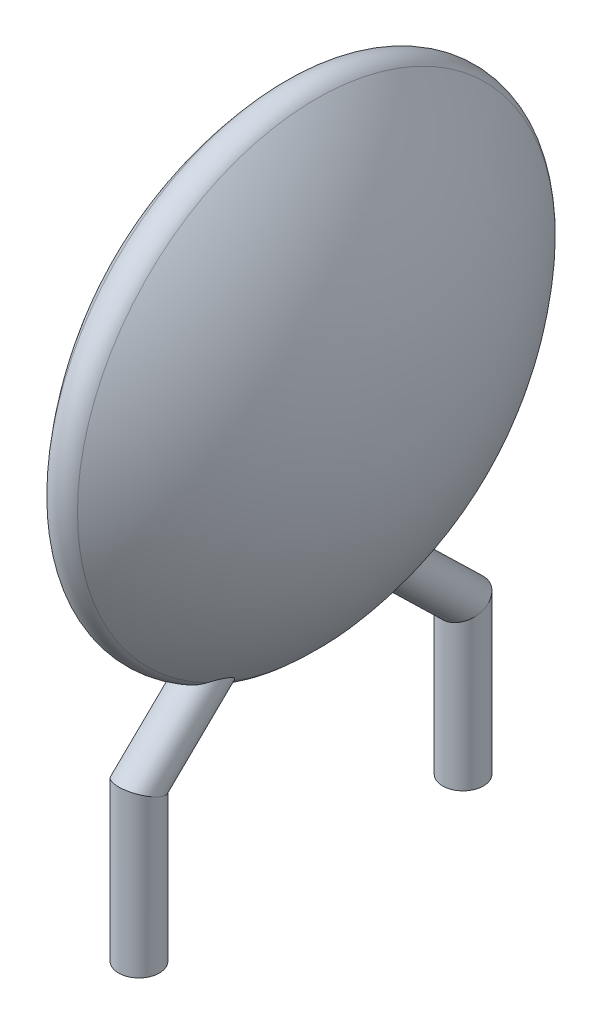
SolidWorks part; units mm, degrees
ref_plane "Plan1" through (0, 0, 0) normal (0, 0, 1) x (1, 0, 0)
ref_plane "Plan2" through (0, 0, 0) normal (0, 1, 0) x (1, 0, 0)
ref_plane "Plan3" through (0, 0, 0) normal (1, 0, 0) x (0, 0, -1)
sketch "Esquisse1" plane through (0, 0, 0) normal (0, 0, 1) x (1, 0, 0)
  line L0 (0, 0) -> (40, 0) construction
  line L1 (0, 2.5) -> (20, 2.5) construction
  line L2 (-1, 2.2331) -> (-1, -1.0149) construction
  line L3 (0, 0) -> (-2.4827, 0) construction
  line L4 (0, 0) -> (0, 3.6725) construction
  line L5 (-1, 0) -> (1, 0)
  arc A0 (-1, 0) -> (-0.1501, 2.3401) centre (2.4123, 0.0851) cw
  arc A1 (1, 0) -> (0.1501, 2.3401) centre (-2.4123, 0.0851) ccw
  arc A2 (-0.1501, 2.3401) -> (0.1501, 2.3401) centre (0, 2.2079) cw
  dimension "D3" = 0.2
  dimension "D1" = 2.5
  dimension "D2" = 1
revolve "Base-Révolution" add sketch "Esquisse1" angle 360 about L0
sketch "Esquisse2" plane through (0, 0, 0) normal (0, 1, 0) x (1, 0, 0)
  line L0 (0, 0) -> (2.085, 0) construction
  line L1 (0, 0) -> (40, 0) construction
  circle A0 centre (0, 0.813) radius 0.2
  dimension "D1" = 0.4
sketch "Esquisse3" plane through (0, 0, 0) normal (1, 0, 0) x (0, 0, -1)
  line L0 (0.813, 0) -> (0.813, -2.0121)
  line L1 (0.813, -2.0121) -> (1.5875, -2.765)
  line L2 (1.5875, -2.765) -> (1.5875, -4.2606)
  dimension "D1" = 1.5875
sweep "Boss.-Balayage1" add profiles "Esquisse2" path "Esquisse3"
mirror "Symétrie1" about plane through (0, 0, 0) normal (0, 0, 1)
sketch "Esquisse4" plane through (0, 0, 0) normal (1, 0, 0) x (0, 0, -1)
  line L0 (-0.7059, -2.3177) -> (0.6532, -2.3177)
  arc A0 (-0.7945, -2.2731) -> (0.7945, -2.2731) centre (0, 0) ccw construction
extrude "Enlèv. mat.-Extru.1" cut sketch "Esquisse4" against normal through all and the other way through all flip side to cut
sketch "Esquisse5" plane through (0, -2.3177, 0) normal (0, -1, 0) x (1, 0, 0)
  line L0 (0, 0) -> (0, 1.4812) construction
  line L1 (0, 0) -> (0, -1.3118) construction
